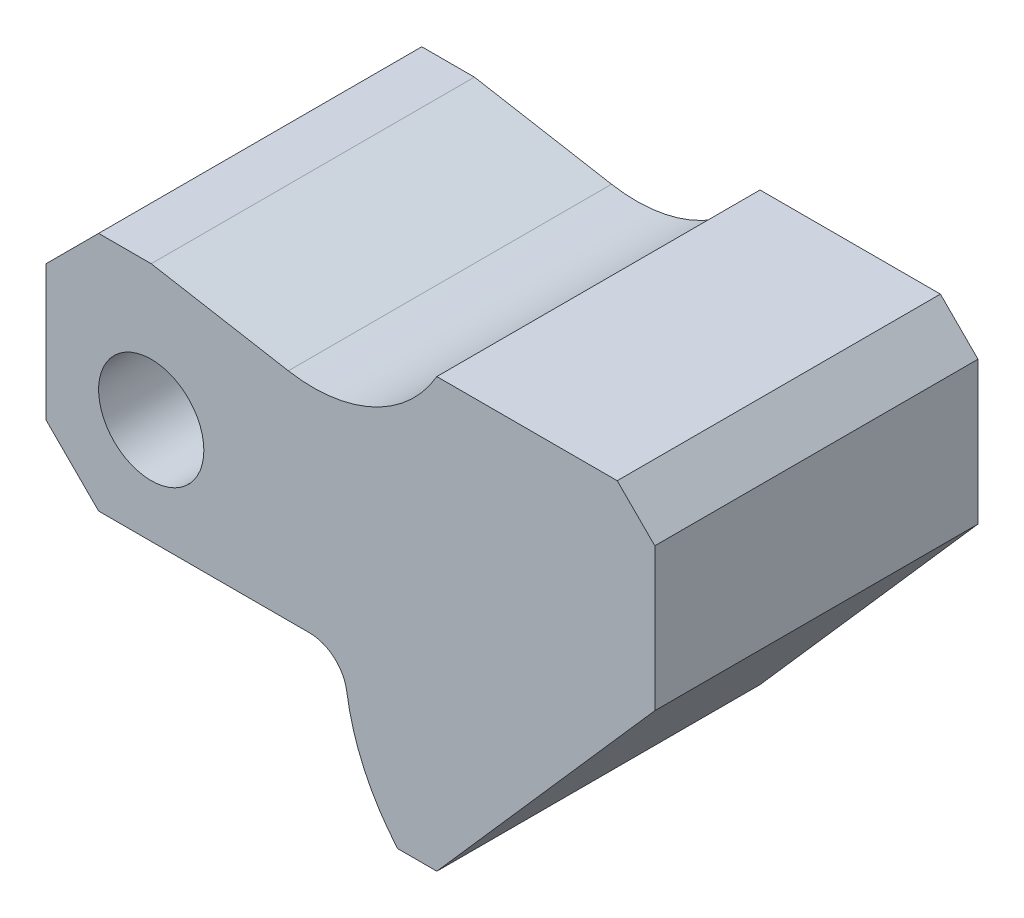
SolidWorks part; units mm, degrees
ref_plane "Front" through (0, 0, 0) normal (0, 0, 1) x (1, 0, 0)
ref_plane "Top" through (0, 0, 0) normal (0, 1, 0) x (1, 0, 0)
ref_plane "Right" through (0, 0, 0) normal (1, 0, 0) x (0, 0, -1)
sketch "Sketch1" plane through (0, 0, 0) normal (0, 0, 1) x (1, 0, 0)
  line L0 (0, 0) -> (0, 32)
  line L1 (0, 32) -> (14, 32)
  line L2 (14, 32) -> (32.2431, 28.7833)
  line L3 (52, 38) -> (81, 38)
  line L4 (81, 38) -> (81, 14)
  line L5 (81, 14) -> (52, -19)
  line L6 (52, -19) -> (46.7881, -19)
  line L7 (0, 0) -> (35.0666, 0)
  arc A0 (32.2431, 28.7833) -> (52, 38) centre (35.5424, 47.4946) ccw
  arc A1 (35.0666, 0) -> (40.0123, -4.2647) centre (35.0666, -5) cw
  arc A2 (40.0123, -4.2647) -> (46.7881, -19) centre (68.697, 0) ccw
extrude "Boss-Extrude1" add sketch "Sketch1" along normal mid plane 43
chamfer "Chamfer1" distance 7 angle 45 2 edges at (0, 0, 0) (0, 32, 0)
chamfer "Chamfer2" distance 5 angle 45 1 edges at (81, 38, 0)
sketch "Sketch2" plane through (0, 0, 21.5) normal (0, 0, 1) x (1, 0, 0)
  line L0 (7, 0) -> (35.0666, 0) construction
  line L1 (0, 25) -> (0, 7) construction
  circle A0 centre (14, 14) radius 7
  dimension "D3" = 14
  dimension "D1" = 14
  dimension "D2" = 14
extrude "Cut-Extrude1" cut sketch "Sketch2" against normal through all
equation "\"A\"= 81"
equation "\"B\"= 57"
equation "\"C\"= 43"
equation "\"D3@Sketch1\"=\"A\""
equation "\"D8@Sketch1\"=\"B\""
equation "\"D1@Boss-Extrude1\"=\"C\""
